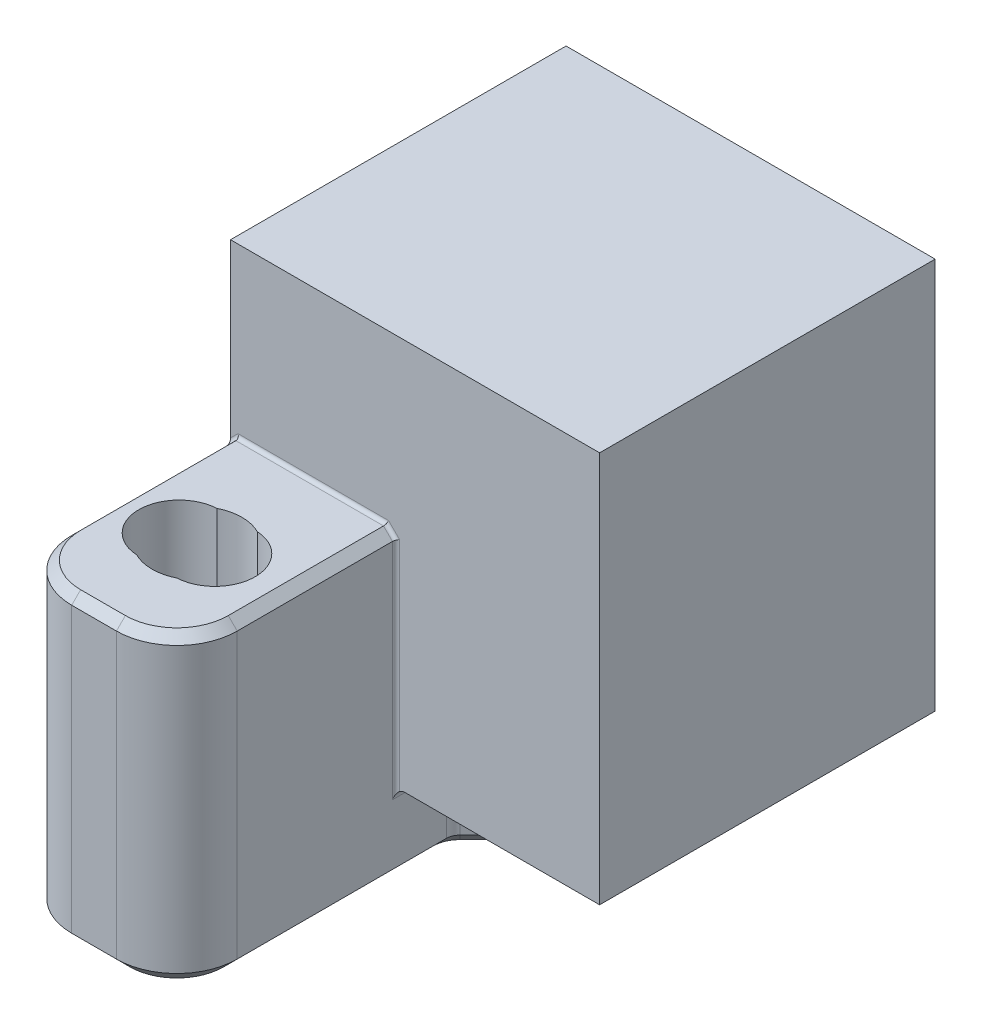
SolidWorks part; units mm, degrees
ref_plane "Front Plane" through (0, 0, 0) normal (0, 0, 1) x (1, 0, 0)
ref_plane "Top Plane" through (0, 0, 0) normal (0, 1, 0) x (1, 0, 0)
ref_plane "Right Plane" through (0, 0, 0) normal (1, 0, 0) x (0, 0, -1)
sketch "Sketch1" plane through (0, 0, 0) normal (0, 0, 1) x (1, 0, 0)
  line L5 (0, -22.225) -> (-9.525, -22.225)
  line L6 (-20.955, -26.924) -> (-20.955, 0)
  line L7 (-20.955, 0) -> (0, 0)
  line L8 (0, 0) -> (0, -22.225)
  line L10 (-9.525, -22.225) -> (-9.525, -26.924)
  line L13 (-9.525, -26.924) -> (-20.955, -26.924)
  point P6 (0, -22.225)
  dimension "D2" = 26.924
  dimension "D5" = 22.225
  dimension "D6" = 20.955
  dimension "D9" = 11.43
  dimension "D10" = 4.699
extrude "Boss-Extrude1" add sketch "Sketch1" along normal mid plane 19.05 contours L5 L10 L13 L6 L7 L8
sketch "Sketch7" plane through (0, -26.924, 0) normal (0, -1, 0) x (1, 0, 0)
  line L0 (0, 9.525) -> (-9.525, 9.525) construction
  line L1 (-20.955, 9.525) -> (-11.557, 9.525)
  line L2 (-20.955, 9.525) -> (-20.955, 18.542)
  line L3 (-17.526, 21.971) -> (-14.986, 21.971)
  line L4 (-11.557, 9.525) -> (-11.557, 18.542)
  line L8 (-20.955, 9.525) -> (-20.955, -9.525) construction
  line L9 (-17.526, 13.589) -> (-15.494, 13.589)
  line L11 (-17.526, 18.161) -> (-15.494, 18.161)
  arc A2 (-14.986, 21.971) -> (-11.557, 18.542) centre (-14.986, 18.542) cw
  arc A3 (-20.955, 18.542) -> (-17.526, 21.971) centre (-17.526, 18.542) cw
  arc A4 (-17.526, 18.161) -> (-17.526, 13.589) centre (-17.526, 15.875) ccw
  arc A5 (-15.494, 13.589) -> (-15.494, 18.161) centre (-15.494, 15.875) ccw
  circle A6 centre (-15.875, 15.875) radius 2.0828 construction
  point P9 (-16.51, 13.589)
  dimension "D1" = 3.429
  dimension "D2" = 4.572
  dimension "D4" = 6.604
  dimension "D5" = 4.1656
  dimension "D8" = 1.8542
  dimension "D3" = 9.398
  dimension "D6" = 15.875
  dimension "D7" = 12.446
  dimension "D9" = 15.875
  dimension "D10" = 4.445
extrude "Boss-Extrude2" add sketch "Sketch7" against normal offset from surface (17.399 mm away) 9.525
sketch "Sketch8" plane through (0, -26.924, 0) normal (0, -1, 0) x (1, 0, 0)
  line L0 (-9.525, -9.525) -> (-20.955, -9.525) construction
  line L1 (-20.955, -9.525) -> (-17.526, -9.525)
  line L2 (-20.955, -9.525) -> (-20.955, 11.2522)
  line L3 (-20.955, 11.2522) -> (-19.1135, 11.2522)
  line L4 (-17.526, -9.525) -> (-17.526, 9.6647)
  line L5 (-20.955, 9.525) -> (-11.557, 9.525) construction
  line L6 (-20.955, 18.542) -> (-20.955, -9.525) construction
  arc A0 (-19.1135, 11.2522) -> (-17.526, 9.6647) centre (-19.1135, 9.6647) cw
  point P9 (-17.526, 11.2522)
  dimension "D3" = 1.5875
  dimension "D1" = 3.429
  dimension "D2" = 1.7272
extrude "Cut-Extrude2" cut sketch "Sketch8" against normal blind 2.54
sketch "Sketch11" plane through (0, -26.924, 0) normal (0, -1, 0) x (1, 0, 0)
  line L0 (-11.557, 6.35) -> (-9.525, 4.318)
  line L1 (-9.525, 9.525) -> (-9.525, -9.525) construction
  line L6 (-9.525, 4.318) -> (-9.525, 9.525)
  line L12 (-9.525, 9.525) -> (-11.557, 9.525)
  line L15 (0, 9.525) -> (-9.525, 9.525) construction
  line L17 (-11.557, 9.525) -> (-11.557, 6.35)
  line L18 (-9.525, -4.318) -> (-14.732, -9.525)
  line L19 (-9.525, -9.525) -> (-17.526, -9.525) construction
  line L20 (-14.732, -9.525) -> (-9.525, -9.525)
  line L21 (-9.525, -9.525) -> (-9.525, -4.318)
  dimension "D1" = 45
  dimension "D4" = 5.207
  dimension "D3" = 45
  dimension "D2" = 5.207
extrude "Cut-Extrude3" cut sketch "Sketch11" against normal up to surface (4.699 mm away)
fillet "Fillet7" radius 0.762 4 edges at (-14.732, -24.5745, -9.525) (-9.525, -24.5745, -4.318) (-9.525, -24.5745, 4.318) (-11.557, -24.5745, 6.35)
chamfer "Chamfer5" distance 0.762 angle 45 12 edges at (-11.557, -26.924, 12.6038) (-12.5613, -26.924, 20.9667) (-16.256, -26.924, 21.971) (-19.9507, -26.924, 20.9667) (-20.955, -26.924, 14.8971) (-16.2868, -26.924, -9.525) (-17.526, -26.924, 0.0698) (-17.991, -26.924, 10.7872) (-20.0342, -26.924, 11.2522) (-9.525, -26.924, 0) (-12.1285, -26.924, -6.9215) (-10.541, -26.924, 5.334)
chamfer "Chamfer6" distance 0.508 angle 45 9 edges at (-20.955, -9.525, 14.0335) (-19.9507, -9.525, 20.9667) (-16.256, -9.525, 21.971) (-12.5613, -9.525, 20.9667) (-11.557, -9.525, 14.0335) (-17.526, -25.273, -9.525) (-20.955, -25.273, 11.2522) (-19.2405, -24.384, -9.525) (-20.955, -24.384, 0.8636)
fillet "Fillet5" radius 0.2032 4 edges at (-11.557, -16.129, 9.525) (-11.811, -9.779, 9.525) (-16.256, -9.525, 9.525) (-20.701, -9.779, 9.525)
fillet "Fillet4" radius 0.2032 5 edges at (-19.7802, -24.384, 11.2522) (-17.991, -24.384, 10.7872) (-17.526, -24.384, 0.3239) (-20.701, -24.13, 11.5062) (-17.272, -24.13, -9.271)
hole_wizard "1/4-20 Tapped Hole1" positions "Sketch9" profile "Sketch10" tap size "1/4-20" standard "ANSI Inch"
sketch "Sketch9" plane through (0, -9.525, 0) normal (0, 1, 0) x (1, 0, 0)
  line L0 (-20.955, -9.525) -> (0, -9.525) construction
  line L3 (-17.526, -13.589) -> (-15.494, -13.589) construction
  point P0 (-16.51, -15.875)
  point P15 (-16.51, -13.589)
  dimension "D1" = 6.35
sketch "Sketch10" plane through (-16.51, -9.525, 15.875) normal (1, 0, 0) x (0, 0, 1)
  line L0 (0, 0) -> (0, 17.399)
  line L1 (0, 17.399) -> (2.5527, 17.399)
  line L2 (2.5527, 17.399) -> (2.5527, 0)
  line L5 (2.5527, 0) -> (0, 0)
  line L11 (0, -6.35) -> (0, 107.95) construction
  dimension "Thru Tap Drill Dia." = 5.1054
  dimension "Thru Tap Drill Depth" = 17.399
fillet "Fillet6" radius 0.508 8 edges at (-9.525, -22.225, 0) (-11.557, -22.225, 8.1969) (-11.499, -22.225, 6.374) (-10.541, -22.225, 5.334) (-9.583, -22.225, 4.294) (-14.756, -22.225, -9.467) (-12.1285, -22.225, -6.9215) (-9.583, -22.225, -4.294)
